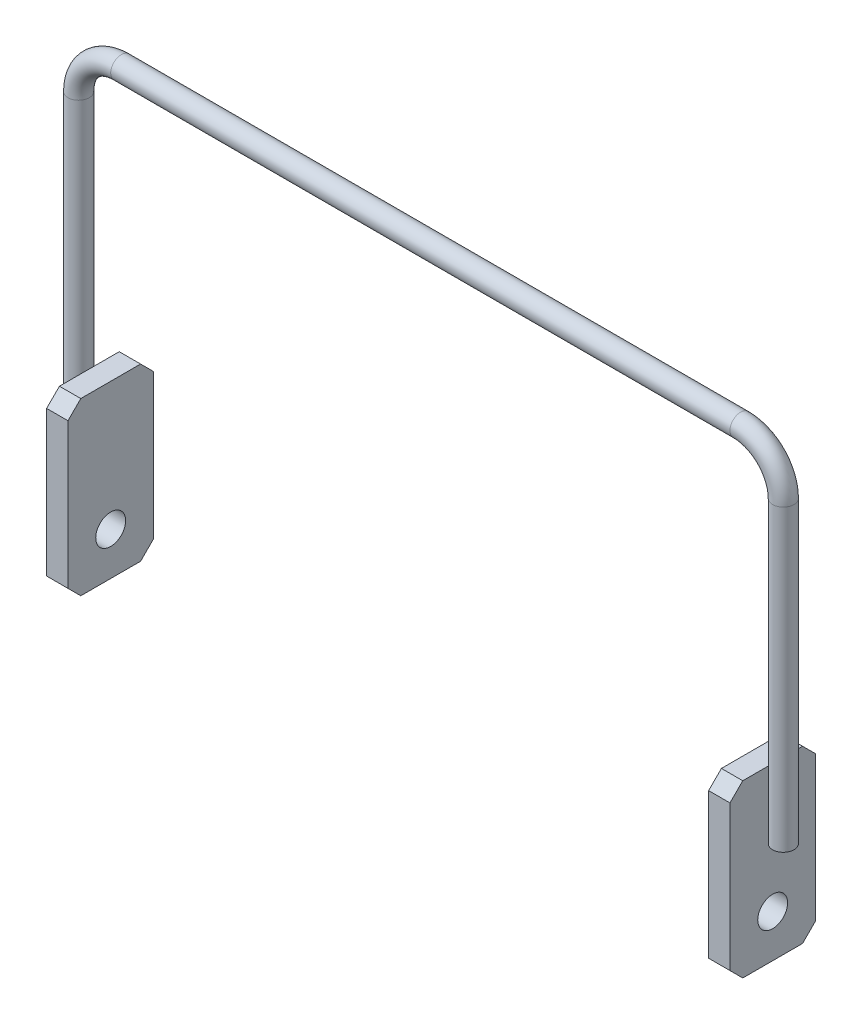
SolidWorks part; units mm, degrees
ref_plane "Plan de face" through (0, 0, 0) normal (0, 0, 1) x (1, 0, 0)
ref_plane "Plan de dessus" through (0, 0, 0) normal (0, 1, 0) x (1, 0, 0)
ref_plane "Plan de droite" through (0, 0, 0) normal (1, 0, 0) x (0, 0, -1)
sketch "Esquisse1" plane through (0, 0, 0) normal (0, 0, 1) x (1, 0, 0)
  line L0 (0, 0) -> (0, 35.6078) construction
  line L1 (75, 40) -> (75, 0)
  line L2 (-80, 40) -> (-75, 40)
  line L3 (-80, 40) -> (-80, 0)
  line L4 (-80, 0) -> (-75, 0)
  line L5 (-75, 40) -> (-75, 0)
  line L6 (80, 0) -> (75, 0)
  line L7 (80, 40) -> (80, 0)
  line L8 (80, 40) -> (75, 40)
  dimension "D1" = 75
  dimension "D2" = 5
  dimension "D3" = 40
extrude "Extrusion1" add sketch "Esquisse1" along normal mid plane 20
sketch "Esquisse2" plane through (-80, 0, 0) normal (-1, 0, 0) x (0, 0, 1)
  line L0 (10, 0) -> (-10, 0) construction
  circle A0 centre (0, 10) radius 3.5
  dimension "D1" = 7
  dimension "D2" = 10
extrude "Enlèv. mat.-Extru.1" cut sketch "Esquisse2" against normal through all
ref_plane "Plan1" through (0, 25, 0) normal (0, 1, 0) x (-1, 0, 0)
sketch "Esquisse3" plane through (0, 25, 0) normal (0, 1, 0) x (-1, 0, 0)
  line L0 (-80, 10) -> (-80, -10) construction
  circle A0 centre (-82.5, 0) radius 2.5
  dimension "D1" = 5
  dimension "D2" = 2.5
sketch "Esquisse4" plane through (0, 0, 0) normal (0, 0, 1) x (1, 0, 0)
  line L0 (82.5, 25) -> (82.5, 95)
  line L1 (85, 25) -> (80, 25) construction
  line L2 (72.5, 105) -> (-72.5, 105)
  line L3 (-82.5, 95) -> (-82.5, 25)
  line L4 (-80, 40) -> (-80, 0) construction
  arc A0 (72.5, 105) -> (82.5, 95) centre (72.5, 95) cw
  arc A1 (-82.5, 95) -> (-72.5, 105) centre (-72.5, 95) cw
  dimension "D1" = 10
  dimension "D2" = 2.5
  dimension "D3" = 80
sweep "Balayage1" add profiles "Esquisse3" path "Esquisse4"
chamfer "Chanfrein1" distance 3 angle 45 4 edges at (-77.5, 40, -10) (-77.5, 0, -10) (-77.5, 40, 10) (-77.5, 0, 10)
chamfer "Chanfrein2" distance 3 angle 45 4 edges at (77.5, 40, -10) (77.5, 40, 10) (77.5, 0, -10) (77.5, 0, 10)
